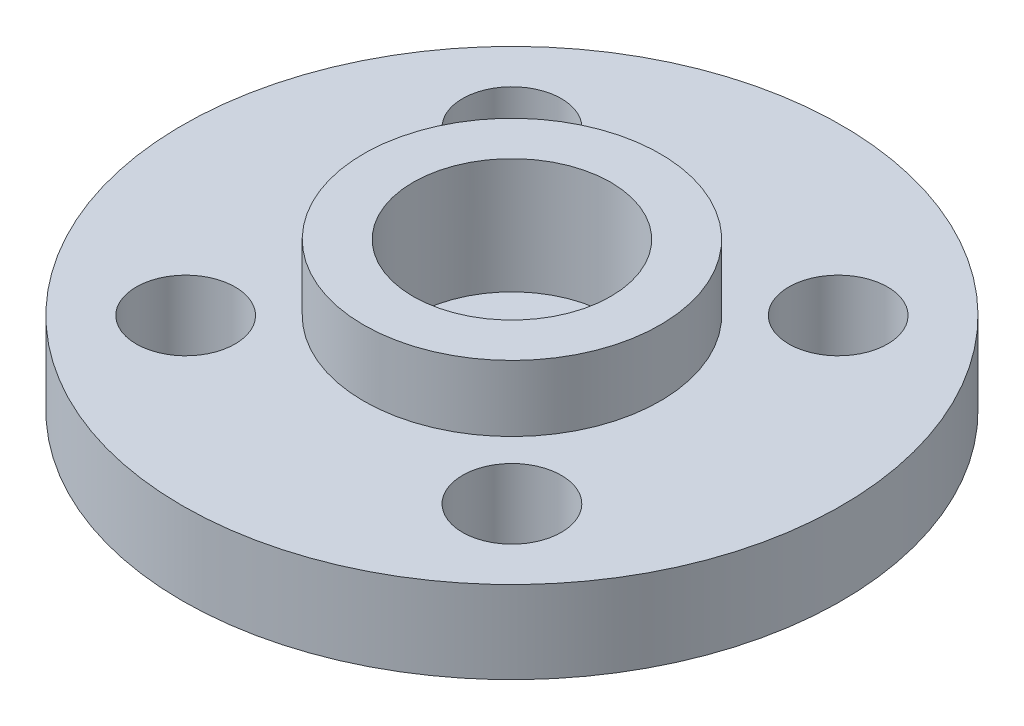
SolidWorks part; units mm, degrees
ref_plane "Front Plane" through (0, 0, 0) normal (0, 0, 1) x (1, 0, 0)
ref_plane "Top Plane" through (0, 0, 0) normal (0, 1, 0) x (1, 0, 0)
ref_plane "Right Plane" through (0, 0, 0) normal (1, 0, 0) x (0, 0, -1)
sketch "Sketch1" plane through (0, 0, 0) normal (0, 1, 0) x (1, 0, 0)
  line L1 (-4.9497, -4.9497) -> (4.9497, -4.9497) construction
  line L2 (-4.9497, -4.9497) -> (-4.9497, 4.9497) construction
  line L3 (-4.9497, 4.9497) -> (4.9497, 4.9497) construction
  line L4 (4.9497, -4.9497) -> (4.9497, 4.9497) construction
  line L5 (-4.9497, -4.9497) -> (4.9497, 4.9497) construction
  line L6 (-4.9497, 4.9497) -> (4.9497, -4.9497) construction
  circle A0 centre (0, 0) radius 10
  circle A1 centre (0, 0) radius 7 construction
  circle A2 centre (4.9497, 4.9497) radius 1.5
  circle A3 centre (4.9497, -4.9497) radius 1.5
  circle A4 centre (-4.9497, -4.9497) radius 1.5
  circle A5 centre (-4.9497, 4.9497) radius 1.5
  circle A6 centre (0, 0) radius 3
  dimension "D1" = 20
  dimension "D2" = 14
  dimension "D3" = 3
  dimension "D4" = 6
extrude "Boss-Extrude1" add sketch "Sketch1" along normal blind 2.5
sketch "Sketch2" plane through (0, 2.5, 0) normal (0, 1, 0) x (1, 0, 0)
  circle A0 centre (0, 0) radius 3 construction
  circle A1 centre (0, 0) radius 3
  circle A2 centre (0, 0) radius 4.5
  dimension "D1" = 9
extrude "Boss-Extrude2" add sketch "Sketch2" along normal blind 2
sketch "Sketch3" plane through (0, 0, 0) normal (0, -1, 0) x (1, 0, 0)
  circle A0 centre (0, 0) radius 3 construction
  circle A1 centre (0, 0) radius 3
  circle A2 centre (0, 0) radius 1
  dimension "D1" = 2
extrude "Boss-Extrude3" add sketch "Sketch3" against normal blind 1
